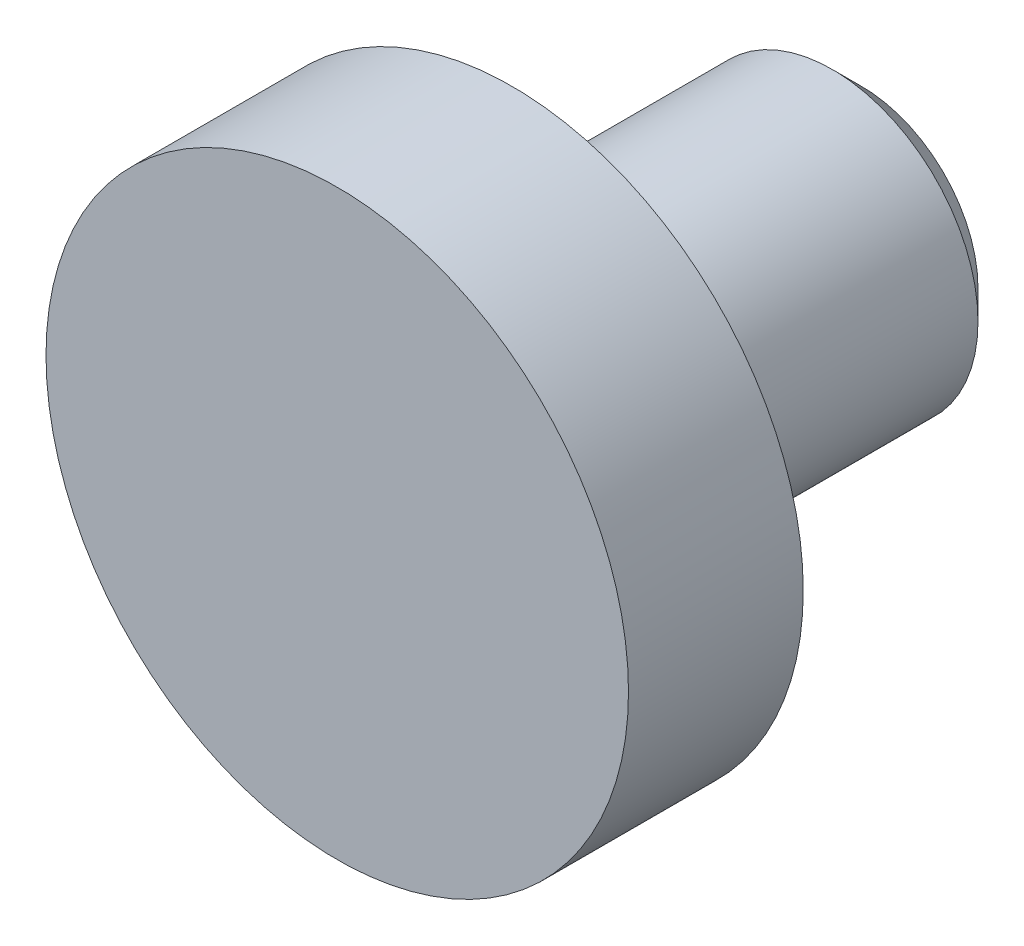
SolidWorks part; units mm, degrees
ref_plane "Plan de face" through (0, 0, 0) normal (0, 0, 1) x (1, 0, 0)
ref_plane "Plan de dessus" through (0, 0, 0) normal (0, 1, 0) x (1, 0, 0)
ref_plane "Plan de droite" through (0, 0, 0) normal (1, 0, 0) x (0, 0, -1)
sketch "Esquisse1" plane through (0, 0, 0) normal (0, 0, 1) x (1, 0, 0)
  circle A0 centre (0, 0) radius 2.5
  dimension "D1" = 5
extrude "Boss.-Extru.1" add sketch "Esquisse1" along normal blind 6
sketch "Esquisse2" plane through (0, 0, 6) normal (0, 0, 1) x (1, 0, 0)
  circle A0 centre (0, 0) radius 5
  dimension "D1" = 10
extrude "Boss.-Extru.2" add sketch "Esquisse2" along normal blind 3
chamfer "Chanfrein1" distance 0.5 angle 45 1 edges at (2.5, 0, 0)
